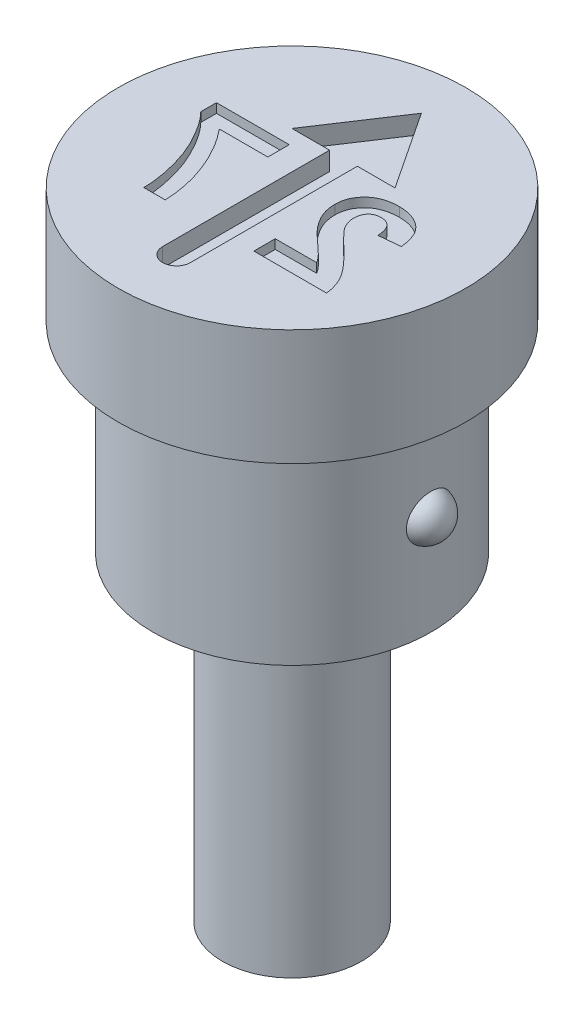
SolidWorks part; units mm, degrees
ref_plane "Front Plane" through (0, 0, 0) normal (0, 0, 1) x (1, 0, 0)
ref_plane "Top Plane" through (0, 0, 0) normal (0, 1, 0) x (1, 0, 0)
ref_plane "Right Plane" through (0, 0, 0) normal (1, 0, 0) x (0, 0, -1)
sketch "Sketch1" plane through (0, 0, 0) normal (0, 0, 1) x (1, 0, 0)
  line L0 (0, 0) -> (0, -13.7) construction
  line L1 (0, -4.125) -> (0, 4.125) construction
  line L2 (0, 0) -> (-3.75, 0)
  line L3 (-3.75, 0) -> (-3.75, -2.5)
  line L4 (-3.75, -2.5) -> (-3, -2.5)
  line L5 (-3, -2.5) -> (-3, -6.8)
  line L6 (-3, -6.8) -> (-1.5, -6.8)
  line L7 (-1.5, -6.8) -> (-1.5, -13.7)
  line L8 (-1.5, -13.7) -> (0, -13.7)
  line L9 (0, -13.7) -> (0, 0)
  dimension "D1" = 7.5
  dimension "D2" = 13.7
  dimension "D3" = 2.5
  dimension "D4" = 6.8
  dimension "D5" = 6
  dimension "D6" = 3
revolve "Revolve1" add sketch "Sketch1" angle 360 about L0
sketch "Sketch3" plane through (0, 0, 0) normal (0, 1, 0) x (1, 0, 0)
  line L0 (0, 2.79) -> (-1.112, 1.11)
  line L1 (-1.112, 1.11) -> (-0.3, 1.11)
  line L2 (-0.3, 1.11) -> (-0.3, -2.49)
  line L3 (0.3, -2.49) -> (0.3, 1.11)
  line L4 (0.3, 1.11) -> (1.112, 1.11)
  line L5 (1.112, 1.11) -> (0, 2.79)
  line L6 (0, 2.79) -> (0, -2.79) construction
  arc A0 (-0.3, -2.49) -> (0.3, -2.49) centre (0, -2.49) ccw
  dimension "D3" = 0.3
  dimension "D1" = 1.68
  dimension "D2" = 67
  dimension "D4" = 5.28
extrude "Cut-Extrude1" cut sketch "Sketch3" against normal blind 0.4
sketch "Sketch4" plane through (0, 0, 0) normal (0, 1, 0) x (1, 0, 0)
  text T0 "27" font "Arial" height 2.4
extrude "Cut-Extrude2" cut sketch "Sketch4" against normal blind 0.2
sketch "Sketch5" plane through (0, 0, 0) normal (0, 0, 1) x (1, 0, 0)
  line L2 (2.8695, -4.15) -> (2.8695, -5.15)
  line L3 (2.8695, -4.15) -> (2.8695, -5.15) construction
  line L4 (-3, -4.65) -> (2.8695, -4.65) construction
  line L5 (-3, -2.5) -> (-3, -6.8) construction
  arc A1 (2.8695, -5.15) -> (2.8695, -4.15) centre (2.8695, -4.65) ccw
  dimension "D1" = 0.5
revolve "Revolve2" add sketch "Sketch5" angle 360 about L2
